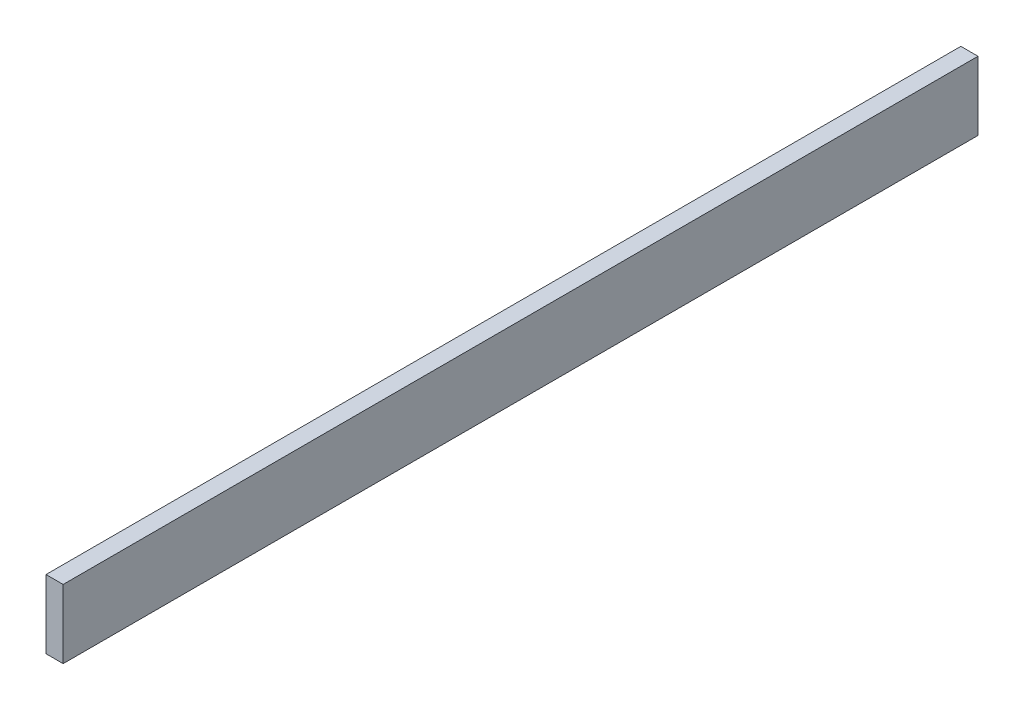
SolidWorks part; units mm, degrees
ref_plane "Front Plane" through (0, 0, 0) normal (0, 0, 1) x (1, 0, 0)
ref_plane "Top Plane" through (0, 0, 0) normal (0, 1, 0) x (1, 0, 0)
ref_plane "Right Plane" through (0, 0, 0) normal (1, 0, 0) x (0, 0, -1)
sketch "Sketch1" plane through (0, 0, 0) normal (1, 0, 0) x (0, 0, -1)
  line L1 (40, -3) -> (-40, -3)
  line L2 (40, -3) -> (40, 3)
  line L3 (40, 3) -> (-40, 3)
  line L4 (-40, -3) -> (-40, 3)
  line L5 (40, -3) -> (-40, 3) construction
  line L6 (40, 3) -> (-40, -3) construction
  point P0 (0, 0)
  dimension "D1" = 6
  dimension "D2" = 80
extrude "Boss-Extrude1" add sketch "Sketch1" along normal blind 1.5
